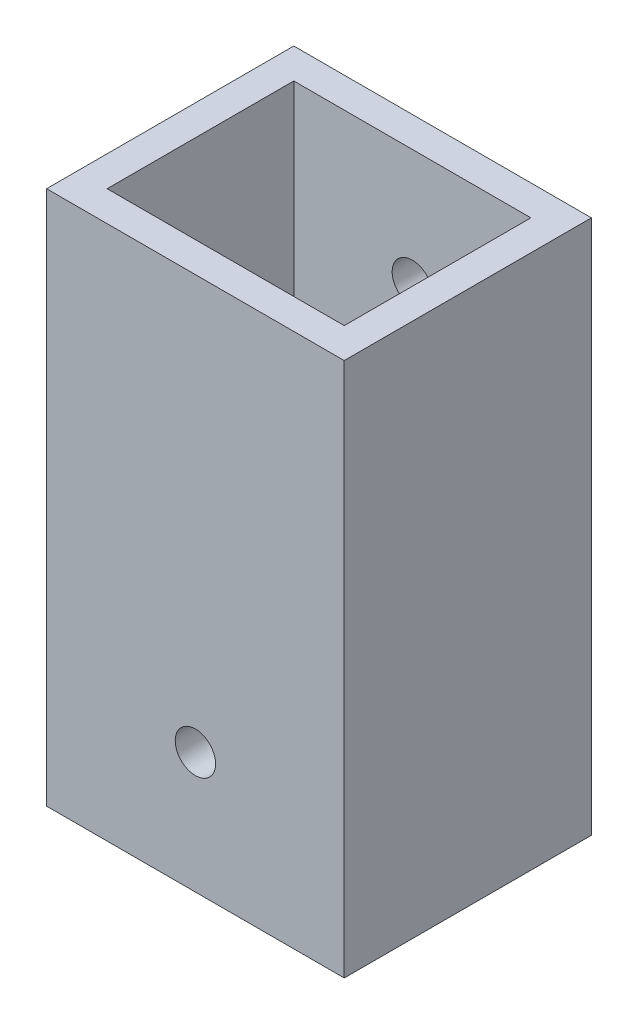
SolidWorks part; units mm, degrees
ref_plane "Front Plane" through (0, 0, 0) normal (0, 0, 1) x (1, 0, 0)
ref_plane "Top Plane" through (0, 0, 0) normal (0, 1, 0) x (1, 0, 0)
ref_plane "Right Plane" through (0, 0, 0) normal (1, 0, 0) x (0, 0, -1)
sketch "Sketch1" plane through (0, 0, 0) normal (0, 1, 0) x (1, 0, 0)
  line L0 (-14.75, 12.25) -> (14.75, 12.25)
  line L1 (-11.75, 9.25) -> (11.75, 9.25)
  line L2 (-11.75, 9.25) -> (-11.75, -9.25)
  line L3 (-11.75, -9.25) -> (11.75, -9.25)
  line L4 (11.75, 9.25) -> (11.75, -9.25)
  line L5 (-11.75, 9.25) -> (11.75, -9.25) construction
  line L6 (-11.75, -9.25) -> (11.75, 9.25) construction
  line L7 (14.75, 12.25) -> (14.75, -12.25)
  line L8 (-14.75, -12.25) -> (14.75, -12.25)
  line L9 (-14.75, 12.25) -> (-14.75, -12.25)
  point P0 (0, 0)
  dimension "D1" = 23.5
  dimension "D2" = 18.5
  dimension "D3" = 3
extrude "Boss-Extrude1" add sketch "Sketch1" along normal blind 50
sketch "Sketch2" plane through (0, 0, -12.25) normal (0, 0, -1) x (-1, 0, 0)
  line L0 (0, 50) -> (0, 0) construction
  line L1 (-14.75, 50) -> (14.75, 50) construction
  circle A0 centre (0, 38.5) radius 2
  dimension "D2" = 4
  dimension "D1" = 11.5
extrude "Cut-Extrude1" cut sketch "Sketch2" against normal blind 14.92
sketch "Sketch3" plane through (0, 0, 0) normal (0, -1, 0) x (1, 0, 0)
  line L1 (-14.75, 12.25) -> (14.75, 12.25)
  line L2 (-14.75, 12.25) -> (-14.75, -12.25)
  line L3 (-14.75, -12.25) -> (14.75, -12.25)
  line L4 (14.75, 12.25) -> (14.75, -12.25)
extrude "Boss-Extrude2" add sketch "Sketch3" along normal blind 3
sketch "Sketch4" plane through (0, 0, -12.25) normal (0, 0, -1) x (-1, 0, 0)
  line L0 (0, -3) -> (0, 50) construction
  line L1 (14.75, -3) -> (-14.75, -3) construction
  line L2 (-14.75, 50) -> (14.75, 50) construction
  circle A0 centre (0, 9) radius 2
  dimension "D1" = 4
  dimension "D2" = 12
extrude "Cut-Extrude2" cut sketch "Sketch4" against normal blind 28
